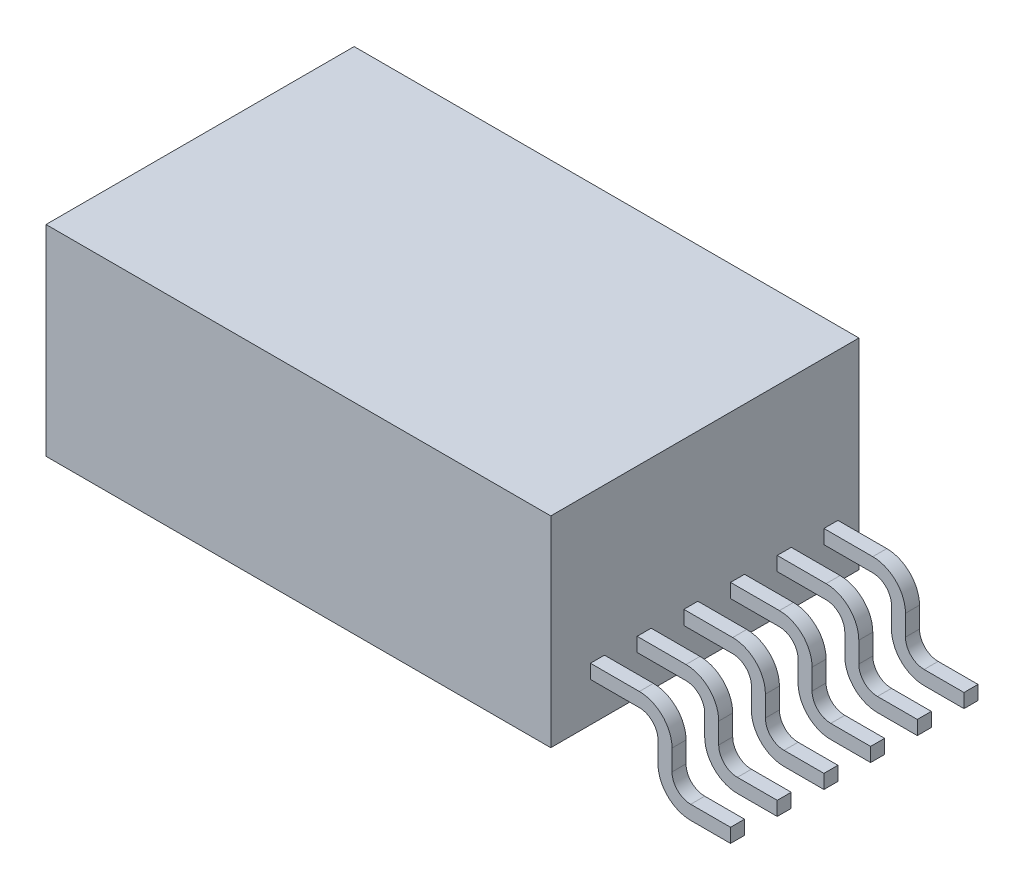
SolidWorks part; units mm, degrees
ref_plane "Ebene vorne" through (0, 0, 0) normal (0, 0, 1) x (1, 0, 0)
ref_plane "Ebene oben" through (0, 0, 0) normal (0, 1, 0) x (1, 0, 0)
ref_plane "Ebene rechts" through (0, 0, 0) normal (1, 0, 0) x (0, 0, -1)
sketch "Skizze1" plane through (0, 0, 0) normal (0, 0, 1) x (1, 0, 0)
  line L0 (0, 0) -> (5.2332, 0)
  line L1 (7.2332, -2) -> (7.2332, -4.2111)
  line L2 (10.7332, -7.7111) -> (15, -7.7111)
  line L3 (0, 1.5) -> (5.2332, 1.5)
  line L4 (8.7332, -2) -> (8.7332, -4.2111)
  line L5 (10.7332, -6.2111) -> (15, -6.2111)
  line L6 (0, 1.5) -> (0, 0)
  line L7 (15, -6.2111) -> (15, -7.7111)
  line L8 (0, 0) -> (7.2332, 0) construction
  line L9 (7.2332, 0) -> (7.2332, -7.7111) construction
  line L10 (8.7332, 1.5) -> (8.7332, -6.2111) construction
  line L11 (8.7332, -6.2111) -> (15, -6.2111) construction
  line L12 (7.2332, -7.7111) -> (15, -7.7111) construction
  line L13 (0, 1.5) -> (8.7332, 1.5) construction
  line L14 (-63.3282, 17.2889) -> (-8.5891, 17.2889) construction
  line L15 (-63.3282, -4.2111) -> (-8.5891, -4.2111) construction
  arc A0 (5.2332, 0) -> (7.2332, -2) centre (5.2332, -2) cw
  arc A1 (8.7332, -4.2111) -> (10.7332, -6.2111) centre (10.7332, -4.2111) ccw
  arc A2 (7.2332, -4.2111) -> (10.7332, -7.7111) centre (10.7332, -4.2111) ccw
  arc A3 (5.2332, 1.5) -> (8.7332, -2) centre (5.2332, -2) cw
  dimension "D2" = 2
  dimension "D3" = 3.5
  dimension "D4" = 25
  dimension "D5" = 15
  dimension "D6" = 3.5
  dimension "D1" = 1.5
extrude "Linear austragen1" add sketch "Skizze1" along normal mid plane 1.5
sketch "Skizze2" plane through (0, 0, 0) normal (0, 0, 1) x (1, 0, 0)
  line L0 (-63.3282, 17.2889) -> (-8.5891, 17.2889) construction
  line L1 (-54.0525, 17.2889) -> (0, 17.2889)
  line L2 (-54.0525, 17.2889) -> (-54.0525, -4.2111)
  line L3 (-54.0525, -4.2111) -> (0, -4.2111)
  line L4 (0, 17.2889) -> (0, -4.2111)
  line L5 (-63.3282, -4.2111) -> (-8.5891, -4.2111) construction
  line L6 (0, 1.5) -> (0, 0) construction
extrude "Linear austragen2" add sketch "Skizze2" along normal blind 30 and the other way blind 3
pattern_linear "Lineares Muster1" count 6 spacing 5 along (0, 0, 1) of "Linear austragen1"
equation "\"LÄNGE\"=0"
equation "\"BREITE\"=0"
equation "\"HÖHE\"=0"
equation "\"DURCHMESSER\"=0"
equation "\"Stückzahl\"= 1"
equation "\"GESAMTHOEHE\"=\"D4@Skizze1\""
equation "\"ABSTAND\"=\"D6@Skizze1\""
